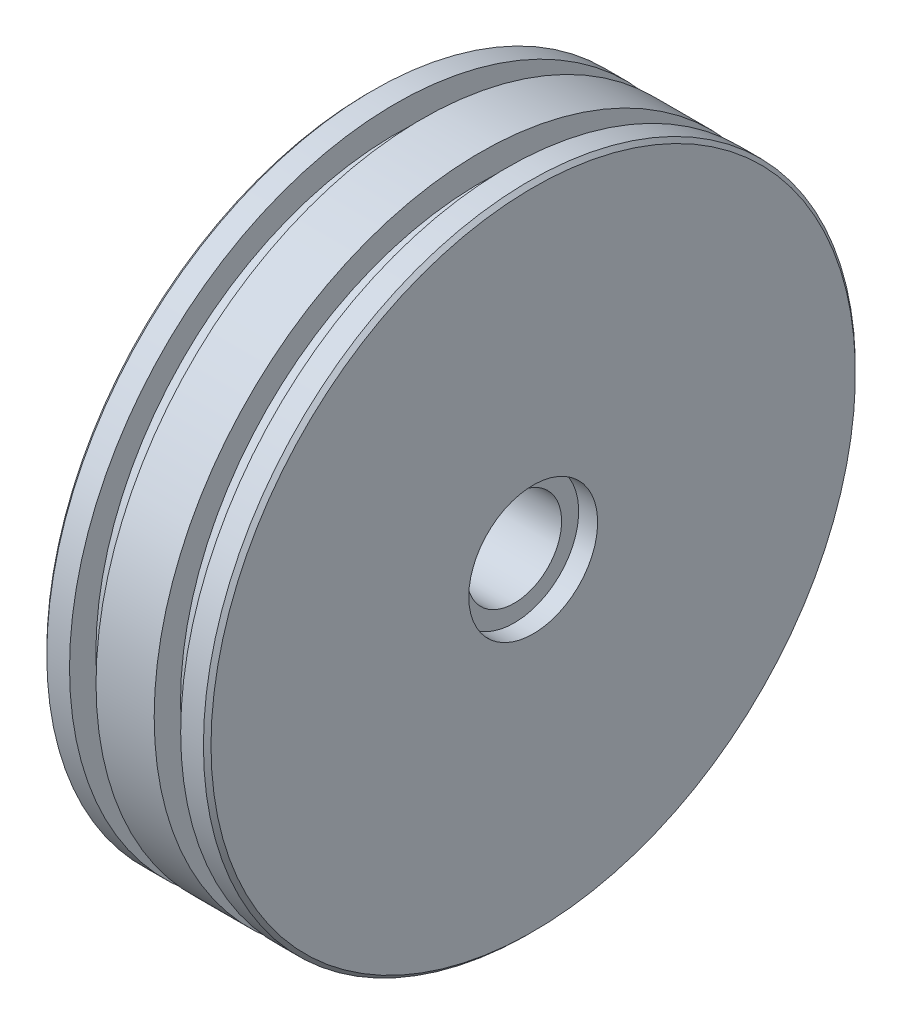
SolidWorks part; units mm, degrees
ref_plane "Plan1" through (0, 0, 0) normal (0, 0, 1) x (1, 0, 0)
ref_plane "Plan2" through (0, 0, 0) normal (0, 1, 0) x (1, 0, 0)
ref_plane "Plan3" through (0, 0, 0) normal (1, 0, 0) x (0, 0, -1)
sketch "Esquisse1" plane through (0, 0, 0) normal (0, 0, 1) x (1, 0, 0)
  line L0 (-110, 0) -> (120, 0) construction
  line L1 (-46.01, 12.5) -> (-46.01, 22)
  line L2 (-46.01, 12.5) -> (-25.01, 12.5)
  line L3 (-49.3415, 86) -> (-34, 86)
  line L4 (-63.3315, 85) -> (-63.3315, 76)
  line L5 (-46.01, 22) -> (-32.359, 22)
  line L6 (-56.3315, 79.05) -> (-49.3415, 79.05)
  line L7 (-20.01, 85) -> (-20.01, 17)
  line L8 (-56.3315, 86) -> (-56.3315, 79.05)
  line L9 (-34, 86) -> (-34, 79.05)
  line L10 (-27.01, 86) -> (-21.01, 86)
  line L11 (-49.3415, 86) -> (-49.3415, 79.05)
  line L12 (-34, 79.05) -> (-27.01, 79.05)
  line L13 (-27.01, 86) -> (-27.01, 79.05)
  line L14 (-56.3315, 86) -> (-62.3315, 86)
  line L15 (-21.01, 86) -> (-20.01, 85)
  line L16 (-30.5046, 23.2508) -> (-28.0131, 29.4175)
  line L17 (-29.1183, 32.0211) -> (-33.7592, 33.8961)
  line L18 (-62.3315, 86) -> (-63.3315, 85)
  line L19 (-26.01, 70) -> (-26.01, 43)
  line L20 (-35.01, 37) -> (-35.01, 35.7505)
  line L22 (-20.01, 17) -> (-25.01, 17)
  line L23 (-60.3315, 73) -> (-29.01, 73)
  line L24 (-32.01, 40) -> (-29.01, 40)
  line L25 (-25.01, 12.5) -> (-25.01, 17)
  arc A0 (-33.7592, 33.8961) -> (-35.01, 35.7505) centre (-33.01, 35.7505) cw
  arc A1 (-28.0131, 29.4175) -> (-29.1183, 32.0211) centre (-29.8675, 30.1667) ccw
  arc A2 (-32.01, 40) -> (-35.01, 37) centre (-32.01, 37) ccw
  arc A3 (-29.01, 40) -> (-26.01, 43) centre (-29.01, 43) ccw
  arc A4 (-32.359, 22) -> (-30.5046, 23.2508) centre (-32.359, 24) ccw
  arc A6 (-60.3315, 73) -> (-63.3315, 76) centre (-60.3315, 76) cw
  arc A7 (-29.01, 73) -> (-26.01, 70) centre (-29.01, 70) cw
  point P24 (-20.01, 86)
  point P29 (-63.3315, 86)
  point P37 (-27.2639, 31.2718)
  point P40 (-31.01, 22)
  dimension "D4" = 15
  dimension "D20" = 3
  dimension "D25" = 3
  dimension "D15" = 17
  dimension "D21" = 2
  dimension "D1" = 1
  dimension "D2" = 1
  dimension "D3" = 7
  dimension "D5" = 79.05
  dimension "D6" = 6.99
  dimension "D7" = 7
  dimension "D8" = 40
  dimension "D9" = 6
  dimension "D10" = 86
  dimension "D11" = 73
  dimension "D12" = 22
  dimension "D13" = 12.5
  dimension "D14" = 5
  dimension "D16" = 22
  dimension "D17" = 10
  dimension "D18" = 26
  dimension "D19" = 15
revolve "Base-Révolution" add sketch "Esquisse1" angle 360 about L0
